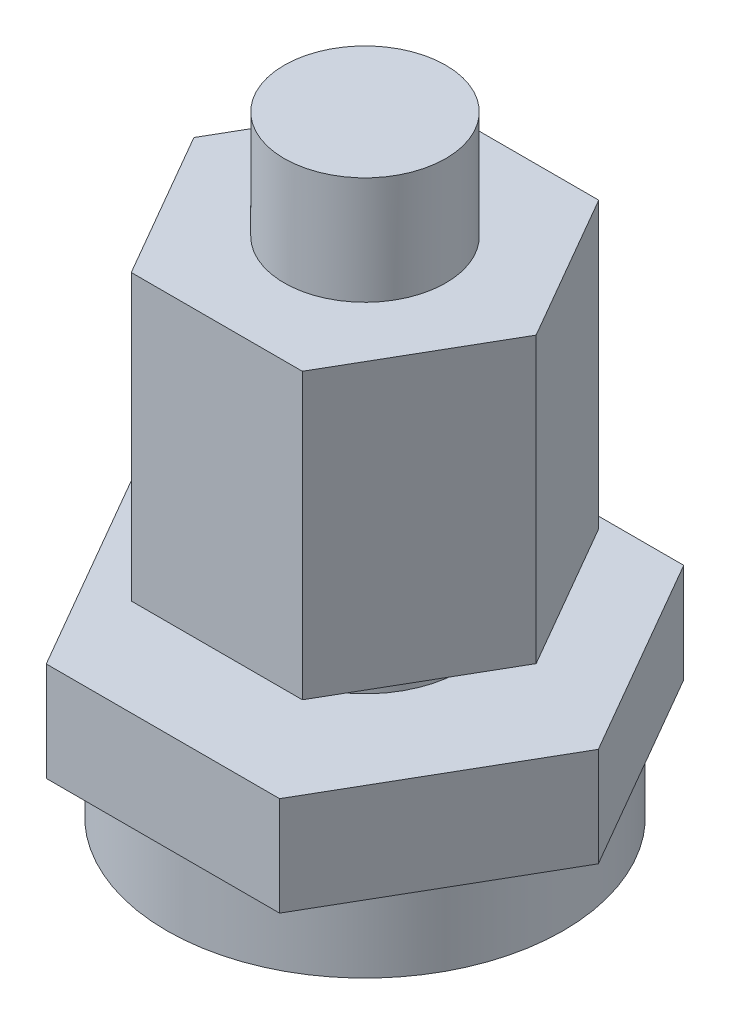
SolidWorks part; units mm, degrees
ref_plane "Front Plane" through (0, 0, 0) normal (0, 0, 1) x (1, 0, 0)
ref_plane "Top Plane" through (0, 0, 0) normal (0, 1, 0) x (1, 0, 0)
ref_plane "Right Plane" through (0, 0, 0) normal (1, 0, 0) x (0, 0, -1)
sketch "Sketch1" plane through (0, 0, 0) normal (0, 1, 0) x (1, 0, 0)
  circle A0 centre (0, 0) radius 11.684
  dimension "D1" = 23.368
extrude "Extrude1" add sketch "Sketch1" along normal blind 4.445
sketch "Sketch2" plane through (0, 4.445, 0) normal (0, 1, 0) x (1, 0, 0)
  line L0 (-6.8741, -11.9062) -> (6.8741, -11.9062)
  line L1 (6.8741, -11.9062) -> (13.7482, 0)
  line L2 (13.7482, 0) -> (6.8741, 11.9062)
  line L3 (6.8741, 11.9062) -> (-6.8741, 11.9062)
  line L4 (-6.8741, 11.9062) -> (-13.7482, 0)
  line L5 (-13.7482, 0) -> (-6.8741, -11.9062)
  line L6 (0, 11.9062) -> (0, -11.9062) construction
  dimension "D1" = 23.8125
  dimension "D2" = 23.8125
extrude "Extrude2" add sketch "Sketch2" along normal blind 5.842
sketch "Sketch3" plane through (0, 10.287, 0) normal (0, 1, 0) x (1, 0, 0)
  circle A0 centre (0, 0) radius 5.715
  dimension "D1" = 11.43
extrude "Extrude3" add sketch "Sketch3" along normal blind 2.54
sketch "Sketch4" plane through (0, 12.827, 0) normal (0, 1, 0) x (1, 0, 0)
  line L0 (-5.041, -8.7312) -> (5.041, -8.7313)
  line L1 (5.041, -8.7313) -> (10.082, 0)
  line L2 (10.082, 0) -> (5.041, 8.7312)
  line L3 (5.041, 8.7312) -> (-5.041, 8.7312)
  line L4 (-5.041, 8.7312) -> (-10.082, 0)
  line L5 (-10.082, 0) -> (-5.041, -8.7312)
  line L6 (0, 8.7312) -> (0, -8.7312) construction
  dimension "D1" = 17.4625
  dimension "D2" = 17.4625
extrude "Extrude4" add sketch "Sketch4" along normal blind 16.764
sketch "Sketch5" plane through (0, 29.591, 0) normal (0, 1, 0) x (1, 0, 0)
  circle A0 centre (0, 0) radius 4.7625
  dimension "D1" = 9.525
extrude "Extrude5" add sketch "Sketch5" along normal blind 6.35
